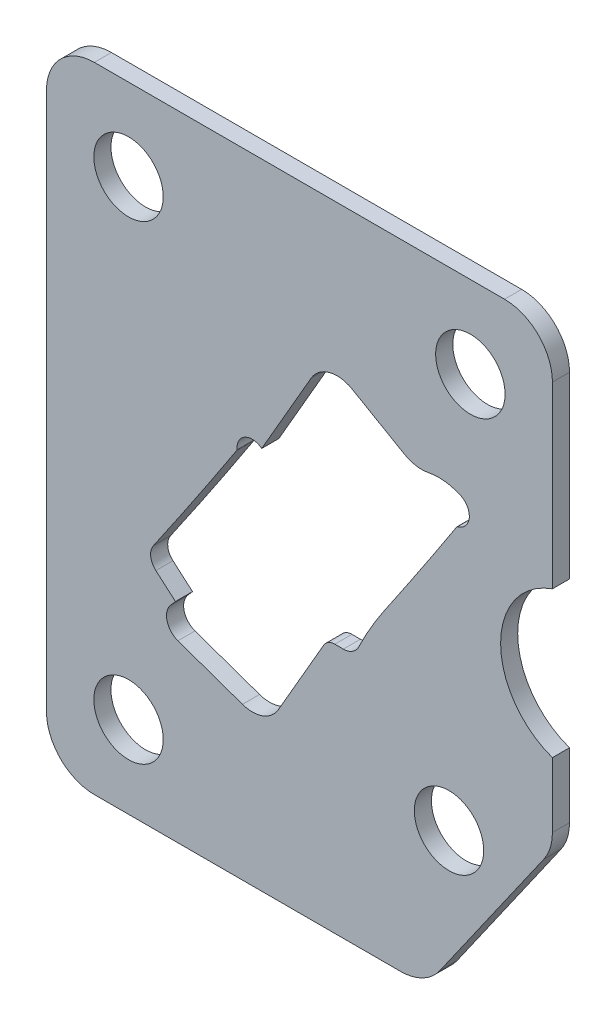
SolidWorks part; units mm, degrees
ref_plane "Front" through (0, 0, 0) normal (0, 0, 1) x (1, 0, 0)
ref_plane "Top" through (0, 0, 0) normal (0, 1, 0) x (1, 0, 0)
ref_plane "Right" through (0, 0, 0) normal (1, 0, 0) x (0, 0, -1)
ref_plane "Plane1"
sketch "Sketch1" plane through (0, 0, -29.21) normal (0, 0, 1) x (1, 0, 0)
  line L4 (-1055.37, 59.055) -> (-1116.33, 59.055)
  line L5 (-1047.75, -6.5337) -> (-1047.75, 51.435)
  line L6 (-1116.33, -36.195) -> (-1070.8035, -36.195)
  line L7 (-1123.95, 51.435) -> (-1123.95, -28.575)
  line L8 (-1055.37, 59.055) -> (-1116.33, 59.055)
  line L9 (-1047.75, -6.5337) -> (-1047.75, 51.435)
  line L10 (-1116.33, -36.195) -> (-1070.8035, -36.195)
  line L11 (-1123.95, 51.435) -> (-1123.95, -28.575)
  line L22 (-1064.5615, -32.9457) -> (-1049.1281, -10.9044)
  line L23 (-1064.5615, -32.9457) -> (-1049.1281, -10.9044)
  arc A4 (-1047.75, 51.435) -> (-1055.37, 59.055) centre (-1055.37, 51.435) ccw
  arc A5 (-1049.1281, -10.9044) -> (-1047.75, -6.5337) centre (-1055.37, -6.5337) ccw
  arc A6 (-1123.95, -28.575) -> (-1116.33, -36.195) centre (-1116.33, -28.575) ccw
  arc A7 (-1116.33, 59.055) -> (-1123.95, 51.435) centre (-1116.33, 51.435) ccw
  arc A8 (-1047.75, 51.435) -> (-1055.37, 59.055) centre (-1055.37, 51.435) ccw
  arc A10 (-1123.95, -28.575) -> (-1116.33, -36.195) centre (-1116.33, -28.575) ccw
  arc A11 (-1116.33, 59.055) -> (-1123.95, 51.435) centre (-1116.33, 51.435) ccw
  arc A22 (-1049.1281, -10.9044) -> (-1047.75, -6.5337) centre (-1055.37, -6.5337) ccw
  arc A23 (-1070.8035, -36.195) -> (-1064.5615, -32.9457) centre (-1070.8035, -28.575) ccw
  arc A24 (-1070.8035, -36.195) -> (-1064.5615, -32.9457) centre (-1070.8035, -28.575) ccw
sketch "Sketch2" plane through (0, 0, -29.21) normal (0, 0, 1) x (1, 0, 0)
  line L4 (-1055.37, 58.547) -> (-1116.33, 58.547)
  line L5 (-1123.442, 51.435) -> (-1123.442, -28.575)
  line L6 (-1116.33, -35.687) -> (-1070.8035, -35.687)
  line L7 (-1048.258, -6.5337) -> (-1048.258, 51.435)
  line L8 (-1055.37, 58.547) -> (-1116.33, 58.547)
  line L9 (-1123.442, 51.435) -> (-1123.442, -28.575)
  line L10 (-1116.33, -35.687) -> (-1070.8035, -35.687)
  line L11 (-1048.258, -6.5337) -> (-1048.258, 51.435)
  line L13 (-1064.9777, -32.6543) -> (-1049.5442, -10.613)
  line L14 (-1064.9777, -32.6543) -> (-1049.5442, -10.613)
  arc A4 (-1116.33, 58.547) -> (-1123.442, 51.435) centre (-1116.33, 51.435) ccw
  arc A5 (-1123.442, -28.575) -> (-1116.33, -35.687) centre (-1116.33, -28.575) ccw
  arc A6 (-1070.8035, -35.687) -> (-1064.9777, -32.6543) centre (-1070.8035, -28.575) ccw
  arc A7 (-1048.258, 51.435) -> (-1055.37, 58.547) centre (-1055.37, 51.435) ccw
  arc A8 (-1116.33, 58.547) -> (-1123.442, 51.435) centre (-1116.33, 51.435) ccw
  arc A9 (-1123.442, -28.575) -> (-1116.33, -35.687) centre (-1116.33, -28.575) ccw
  arc A11 (-1048.258, 51.435) -> (-1055.37, 58.547) centre (-1055.37, 51.435) ccw
  arc A13 (-1070.8035, -35.687) -> (-1064.9777, -32.6543) centre (-1070.8035, -28.575) ccw
  arc A14 (-1049.5442, -10.613) -> (-1048.258, -6.5337) centre (-1055.37, -6.5337) ccw
  arc A15 (-1049.5442, -10.613) -> (-1048.258, -6.5337) centre (-1055.37, -6.5337) ccw
extrude "Boss-Extrude1" add sketch "Sketch2" against normal blind 2.54 flip side to cut
ref_plane "Plane1 QU250515L_Punch5[Mounted in the strip]-2"
sketch "Sketch1 QU250515L_Punch5[Mounted in the strip]-2" plane through (0, 0, -29.21) normal (0, 0, 1) x (1, 0, 0)
  line L9 (-1080.5961, 1.5411) -> (-1079.3261, 1.5411)
  line L10 (-1062.1214, 30.1273) -> (-1062.6006, 30.2961)
  line L11 (-1070.2301, 31.1501) -> (-1078.0343, 35.6558)
  line L12 (-1084.1062, 34.0288) -> (-1091.4599, 21.2919)
  line L14 (-1107.1866, -2.2839) -> (-1104.2781, -4.8097)
  line L15 (-1104.2781, -4.8097) -> (-1104.9815, -5.6197)
  line L16 (-1103.9081, -9.6807) -> (-1094.3166, -13.0614)
  line L17 (-1088.9895, -11.0917) -> (-1082.2459, 0.5886)
  line L18 (-1080.5961, 1.5411) -> (-1079.3261, 1.5411)
  line L19 (-1062.1214, 30.1273) -> (-1062.6006, 30.2961)
  line L20 (-1070.2301, 31.1501) -> (-1078.0343, 35.6558)
  line L21 (-1084.1062, 34.0288) -> (-1091.4599, 21.2919)
  line L23 (-1107.1866, -2.2839) -> (-1104.2781, -4.8097)
  line L24 (-1104.2781, -4.8097) -> (-1104.9815, -5.6197)
  line L25 (-1103.9081, -9.6807) -> (-1094.3166, -13.0614)
  line L26 (-1088.9895, -11.0917) -> (-1082.2459, 0.5886)
  arc A17 (-1079.3261, 1.5411) -> (-1077.0415, 2.971) centre (-1079.3261, 4.0811) ccw
  arc A18 (-1073.3998, 9.2979) -> (-1077.0415, 2.971) centre (-1030.0901, -19.8428) ccw
  arc A19 (-1073.3998, 9.2979) -> (-1062.4829, 25.6746) centre (-1773.1695, 487.596) ccw
  arc A20 (-1062.3309, 25.7828) -> (-1062.4829, 25.6746) centre (-1062.2699, 25.5362) ccw
  arc A21 (-1062.3309, 25.7828) -> (-1062.1214, 30.1273) centre (-1062.876, 27.9863) ccw
  arc A22 (-1062.6006, 30.2961) -> (-1066.6675, 30.5735) centre (-1065.1336, 23.1095) ccw
  arc A23 (-1070.2301, 31.1501) -> (-1066.6675, 30.5735) centre (-1067.6901, 35.5495) ccw
  arc A24 (-1078.0343, 35.6558) -> (-1084.1062, 34.0288) centre (-1080.2568, 31.8063) ccw
  arc A26 (-1091.4599, 21.2919) -> (-1095.1324, 19.3402) centre (-1092.8689, 19.5121) ccw
  arc A27 (-1095.1729, 19.1822) -> (-1095.1324, 19.3402) centre (-1095.3856, 19.321) ccw
  arc A28 (-1107.5664, 0.7195) -> (-1095.1729, 19.1822) centre (-1812.9205, 487.596) ccw
  arc A29 (-1107.5664, 0.7195) -> (-1107.1866, -2.2839) centre (-1105.6982, -0.57) ccw
  arc A30 (-1104.9815, -5.6197) -> (-1103.9081, -9.6807) centre (-1103.0637, -7.2851) ccw
  arc A31 (-1094.3166, -13.0614) -> (-1088.9895, -11.0917) centre (-1092.8389, -8.8692) ccw
  arc A32 (-1080.5961, 1.5411) -> (-1082.2459, 0.5886) centre (-1080.5961, -0.3639) ccw
  arc A33 (-1079.3261, 1.5411) -> (-1077.0415, 2.971) centre (-1079.3261, 4.0811) ccw
  arc A34 (-1073.3998, 9.2979) -> (-1077.0415, 2.971) centre (-1030.0901, -19.8428) ccw
  arc A35 (-1073.3998, 9.2979) -> (-1062.4829, 25.6746) centre (-1773.1695, 487.596) ccw
  arc A36 (-1062.3309, 25.7828) -> (-1062.4829, 25.6746) centre (-1062.2699, 25.5362) ccw
  arc A37 (-1062.3309, 25.7828) -> (-1062.1214, 30.1273) centre (-1062.876, 27.9863) ccw
  arc A38 (-1062.6006, 30.2961) -> (-1066.6675, 30.5735) centre (-1065.1336, 23.1095) ccw
  arc A39 (-1070.2301, 31.1501) -> (-1066.6675, 30.5735) centre (-1067.6901, 35.5495) ccw
  arc A40 (-1078.0343, 35.6558) -> (-1084.1062, 34.0288) centre (-1080.2568, 31.8063) ccw
  arc A42 (-1091.4599, 21.2919) -> (-1095.1324, 19.3402) centre (-1092.8689, 19.5121) ccw
  arc A43 (-1095.1729, 19.1822) -> (-1095.1324, 19.3402) centre (-1095.3856, 19.321) ccw
  arc A44 (-1107.5664, 0.7195) -> (-1095.1729, 19.1822) centre (-1812.9205, 487.596) ccw
  arc A45 (-1107.5664, 0.7195) -> (-1107.1866, -2.2839) centre (-1105.6982, -0.57) ccw
  arc A46 (-1104.9815, -5.6197) -> (-1103.9081, -9.6807) centre (-1103.0637, -7.2851) ccw
  arc A47 (-1094.3166, -13.0614) -> (-1088.9895, -11.0917) centre (-1092.8389, -8.8692) ccw
  arc A48 (-1080.5961, 1.5411) -> (-1082.2459, 0.5886) centre (-1080.5961, -0.3639) ccw
sketch "Sketch3" plane through (0, 0, -29.21) normal (0, 0, 1) x (1, 0, 0)
  circle A0 centre (-1044.448, 13.97) radius 11.5094
  dimension "D1" = 23.0188
extrude "Cut-Extrude1" cut sketch "Sketch3" against normal through all
hole_wizard "Hole1" positions "Point_Sketch" profile "Profil_Sketch" hole size "Ø0.15" standard "ISO"
sketch "Point_Sketch" plane through (-1114.9043, -12.8939, -29.21) normal (0, 0, -1) x (1, 0, 0)
  point P0 (3.6543, 10.6011)
  point P2 (51.2793, 1.0761)
  point P4 (54.4543, -59.2489)
  point P6 (3.6543, -59.2489)
sketch "Profil_Sketch" plane through (-1111.25, -23.495, -29.21) normal (1, 0, 0) x (0, -1, 0)
  line L0 (0, 0) -> (0, 2.54)
  line L1 (0, 2.54) -> (5.1562, 2.54)
  line L2 (5.1562, 2.54) -> (5.1562, 0)
  line L5 (5.1562, 0) -> (0, 0)
  line L11 (0, -6.35) -> (0, 107.95) construction
  dimension "Diameter" = 10.3124
  dimension "Thru Hole Depth" = 2.54
other "usin_DL090_.375-16x1.75-SHCS<1>"
extrude "Cut-Extrude1 QU250515L_Punch5[Mounted in the strip]-2" cut sketch "Sketch1 QU250515L_Punch5[Mounted in the strip]-2" against normal through all
